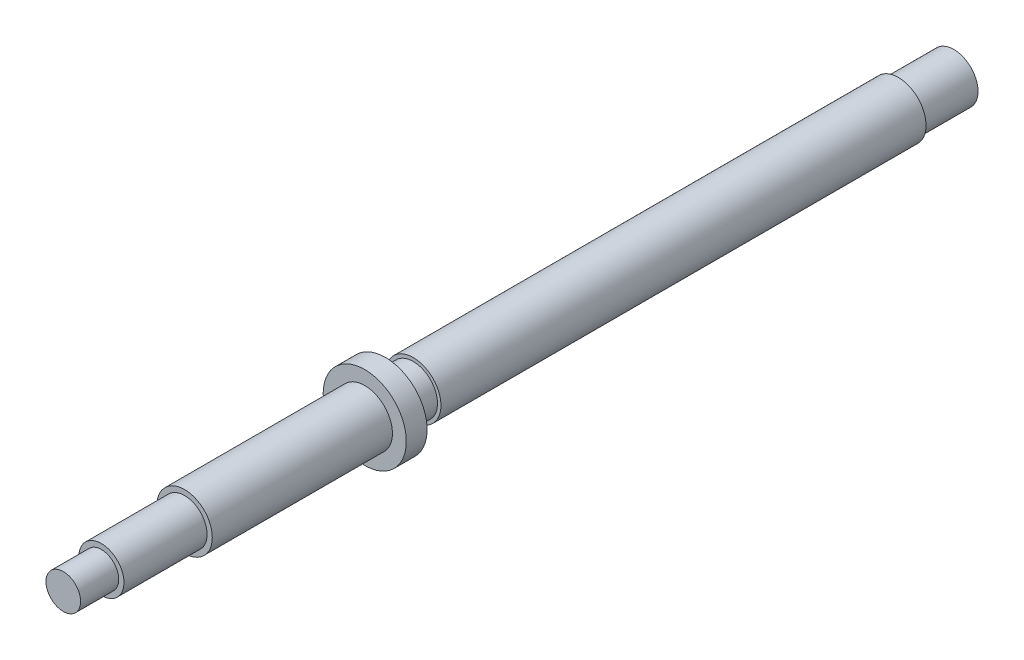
SolidWorks part; units mm, degrees
ref_plane "Front Plane" through (0, 0, 0) normal (0, 0, 1) x (1, 0, 0)
ref_plane "Top Plane" through (0, 0, 0) normal (0, 1, 0) x (1, 0, 0)
ref_plane "Right Plane" through (0, 0, 0) normal (1, 0, 0) x (0, 0, -1)
sketch "Sketch1" plane through (0, 0, 0) normal (0, 0, 1) x (1, 0, 0)
  circle A0 centre (0, 0) radius 8
  dimension "D1" = 16
extrude "Boss-Extrude1" add sketch "Sketch1" along normal mid plane 257
sketch "Sketch2" plane through (0, 0, 128.5) normal (0, 0, 1) x (1, 0, 0)
  circle A0 centre (0, 0) radius 8
  circle A1 centre (0, 0) radius 6.5
  dimension "D1" = 16
  dimension "D2" = 13
extrude "Cut-Extrude1" cut sketch "Sketch2" against normal blind 35
sketch "Sketch3" plane through (0, 0, 128.5) normal (0, 0, 1) x (1, 0, 0)
  circle A0 centre (0, 0) radius 6.5
  circle A1 centre (0, 0) radius 5
  dimension "D1" = 13
  dimension "D2" = 10
extrude "Cut-Extrude2" cut sketch "Sketch3" against normal blind 11
sketch "Sketch4" plane through (0, 0, -128.5) normal (0, 0, -1) x (-1, 0, 0)
  circle A0 centre (0, 0) radius 8
  circle A1 centre (0, 0) radius 7
  dimension "D1" = 16
  dimension "D2" = 14
extrude "Cut-Extrude3" cut sketch "Sketch4" against normal blind 16
sketch "Sketch5" plane through (0, 0, -128.5) normal (0, 0, -1) x (-1, 0, 0)
  circle A0 centre (0, 0) radius 8
  circle A1 centre (0, 0) radius 7
  dimension "D1" = 16
  dimension "D2" = 14
extrude "Cut-Extrude4" cut sketch "Sketch5" against normal blind 8 from offset 156
sketch "Sketch6" plane through (0, 0, 35.5) normal (0, 0, -1) x (-1, 0, 0)
  circle A0 centre (0, 0) radius 7
  circle A1 centre (0, 0) radius 12
  dimension "D1" = 24
  dimension "D2" = 14
extrude "Boss-Extrude2" add sketch "Sketch6" against normal blind 6
